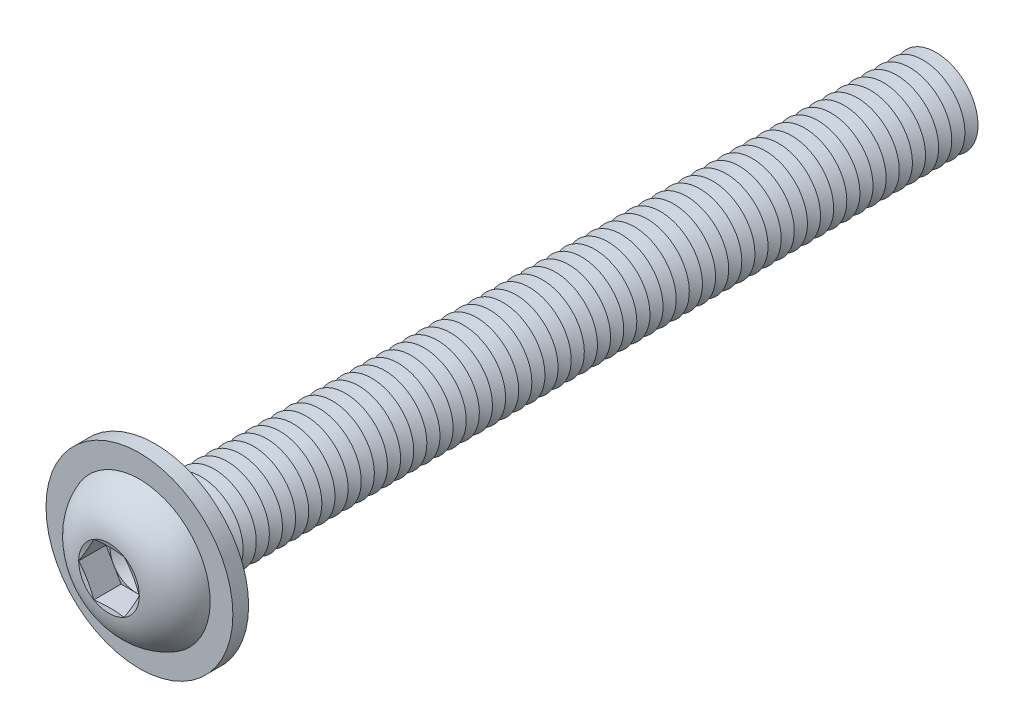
SolidWorks part; units mm, degrees
ref_plane "Front Plane" through (0, 0, 0) normal (0, 0, 1) x (1, 0, 0)
ref_plane "Top Plane" through (0, 0, 0) normal (0, 1, 0) x (1, 0, 0)
ref_plane "Right Plane" through (0, 0, 0) normal (1, 0, 0) x (0, 0, -1)
sketch "Sketch1" plane through (0, 0, 0) normal (1, 0, 0) x (0, 0, -1)
  line L0 (0, 4) -> (0, 7)
  line L3 (0, 4) -> (75, 4)
  line L4 (75, 4) -> (75, 0)
  line L5 (75, 0) -> (-4.4, 0) construction
  line L6 (-4.4, 0) -> (75, 0)
  line L7 (-4.4, 2.8867) -> (-4.4, 1.4434) construction
  line L8 (-4.4, 1.4434) -> (-4.4, 0)
  line L9 (-4.4, 2.8867) -> (-4.0132, 1.4434)
  line L10 (-4.0132, 1.4434) -> (-4.4, 1.4434)
  line L11 (75, 0) -> (22.7481, 0) construction
  line L12 (0, 7) -> (-4.4, 7) construction
  arc A1 (0, 7) -> (-4.4, 2.8867) centre (0, 2.59) ccw
  point P8 (75, 2)
  dimension "D1" = 14
  dimension "D2" = 8
  dimension "D3" = 4.4
  dimension "D4" = 5.7735
  dimension "D5" = 75
  dimension "D6" = 15
revolve "Revolve1" add sketch "Sketch1" angle 360 about L5
fillet "Fillet1" radius 0.625 1 edges at (0, 4, 0)
sketch "Sketch2" plane through (0, 0, 0) normal (1, 0, 0) x (0, 0, -1)
  line L0 (74.375, 4) -> (75.625, 4)
  line L1 (75, 4) -> (0.625, 4) construction
  line L2 (75.625, 4) -> (75, 2.9175)
  line L3 (75, -4) -> (75, 4) construction
  line L4 (75, 2.9175) -> (74.375, 4)
  dimension "D1" = 1.25
revolve "Cut-Revolve1" cut sketch "Sketch2" angle 360 about axis through (0, 0, -75) along (0, 0, -1)
pattern_linear "LPattern1" count 60 spacing 1.25 along (0, 0, 1) of "Cut-Revolve1"
sketch "Sketch3" plane through (0, 0, 4.4) normal (0, 0, 1) x (1, 0, 0)
  line L7 (1.4434, 2.5) -> (-1.4434, 2.5)
  line L8 (-1.4434, 2.5) -> (-2.8867, 0)
  line L9 (-2.8867, 0) -> (-1.4434, -2.5)
  line L10 (-1.4434, -2.5) -> (1.4434, -2.5)
  line L11 (1.4434, -2.5) -> (2.8867, 0)
  line L12 (2.8867, 0) -> (1.4434, 2.5)
  circle A0 centre (0, 0) radius 2.5 construction
  circle A3 centre (0, 0) radius 2.8867 construction
extrude "Cut-Extrude1" cut sketch "Sketch3" against normal blind 2.6
sketch "Sketch4" plane through (0, 0, 1.8) normal (0, 0, 1) x (1, 0, 0)
  line L1 (1.4434, 2.5) -> (-1.4434, 2.5) construction
  circle A0 centre (0, 0) radius 2.5
extrude "Cut-Extrude2" cut sketch "Sketch4" against normal through all draft 60
sketch "Sketch5" plane through (0, 0, 0) normal (0, 0, -1) x (-1, 0, 0)
  circle A0 centre (0, 0) radius 8.9
  circle A1 centre (0, 0) radius 4.625
  circle A2 centre (0, 0) radius 4.625 construction
  dimension "D1" = 17.8
extrude "Boss-Extrude1" add sketch "Sketch5" against normal blind 1.5
